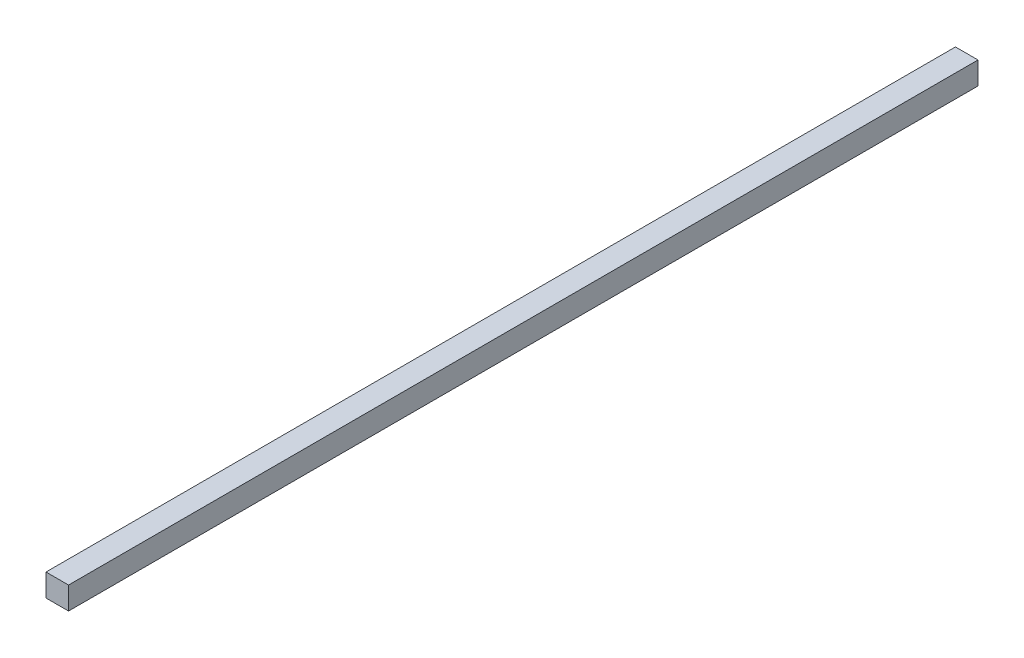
SolidWorks part; units mm, degrees
ref_plane "Front" through (0, 0, 0) normal (0, 0, 1) x (1, 0, 0)
ref_plane "Top" through (0, 0, 0) normal (0, 1, 0) x (1, 0, 0)
ref_plane "Right" through (0, 0, 0) normal (1, 0, 0) x (0, 0, -1)
sketch "Sketch1" plane through (0, 0, 0) normal (0, 0, 1) x (1, 0, 0)
  line L1 (0, 0) -> (12.7, 0)
  line L2 (0, 0) -> (0, 12.7)
  line L3 (0, 12.7) -> (12.7, 12.7)
  line L4 (12.7, 0) -> (12.7, 12.7)
  dimension "D1" = 12.7
  dimension "D2" = 12.7
extrude "Extrude1" add sketch "Sketch1" along normal blind 512.318
